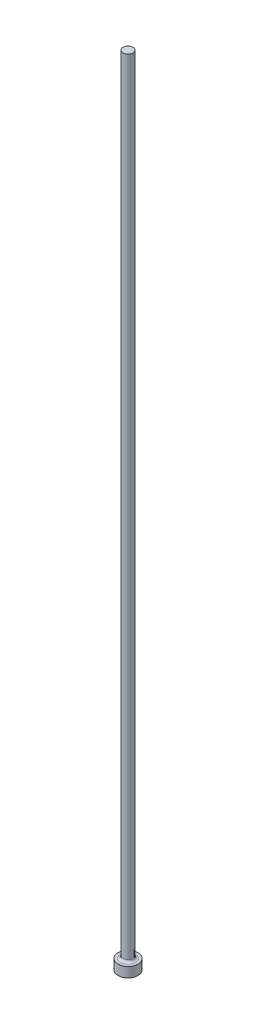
SolidWorks part; units mm, degrees
ref_plane "Front Plane" through (0, 0, 0) normal (0, 0, 1) x (1, 0, 0)
ref_plane "Top Plane" through (0, 0, 0) normal (0, 1, 0) x (1, 0, 0)
ref_plane "Right Plane" through (0, 0, 0) normal (1, 0, 0) x (0, 0, -1)
sketch "Sketch1" plane through (0, 0, 0) normal (0, 0, 1) x (1, 0, 0)
  line L0 (0, 0) -> (3.175, 0)
  line L1 (55, 0) -> (-55, 0) construction
  line L2 (3.175, 0) -> (3.175, 3.175)
  line L3 (3.175, 3.175) -> (2.3495, 3.175)
  line L4 (1.5875, 3.937) -> (1.5875, 254)
  line L5 (1.5875, 254) -> (0, 254)
  line L6 (0, 254) -> (0, 0)
  arc A0 (2.3495, 3.175) -> (1.5875, 3.937) centre (2.3495, 3.937) cw
  dimension "D5" = 0.762
  dimension "D1" = 1.5875
  dimension "D2" = 3.175
  dimension "D3" = 3.175
  dimension "D4" = 254
revolve "Revolve1" add sketch "Sketch1" angle 360 about L6
